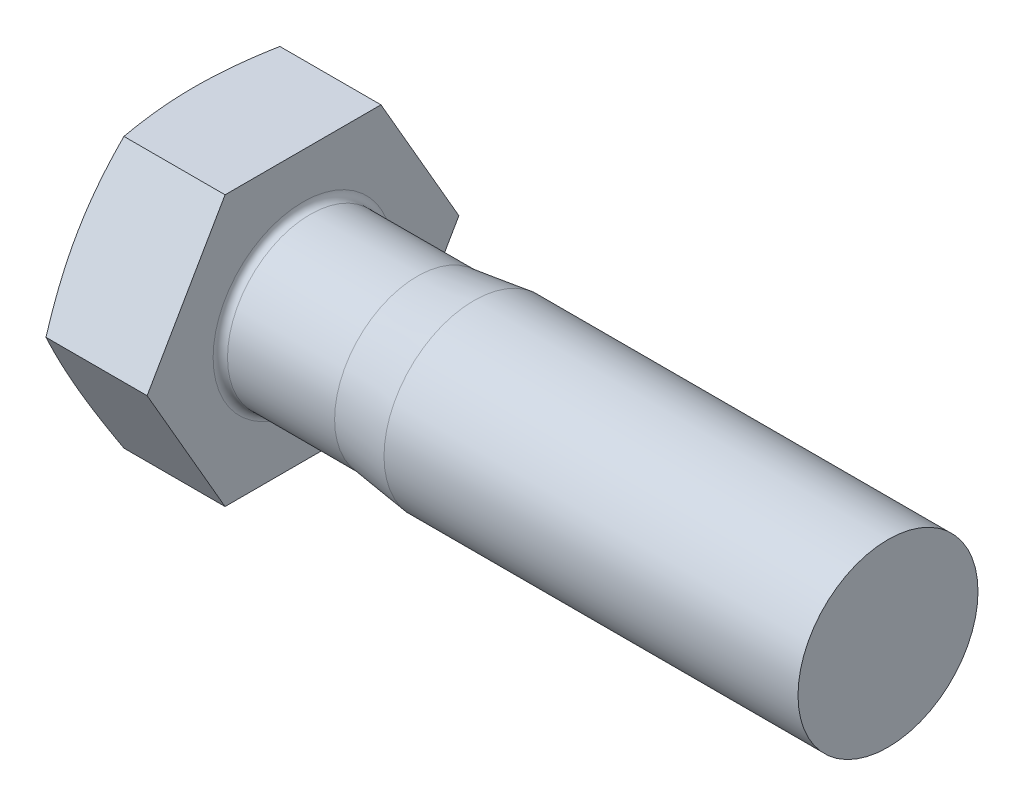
SolidWorks part; units mm, degrees
ref_plane "Front" through (0, 0, 0) normal (0, 0, 1) x (1, 0, 0)
ref_plane "Top" through (0, 0, 0) normal (0, 1, 0) x (1, 0, 0)
ref_plane "Right" through (0, 0, 0) normal (1, 0, 0) x (0, 0, -1)
sketch "Sketch1" plane through (0, 0, 0) normal (1, 0, 0) x (0, 0, -1)
  line L1 (17.3205, 0) -> (8.6603, 15)
  line L2 (8.6603, 15) -> (-8.6603, 15)
  line L3 (-8.6603, 15) -> (-17.3205, 0)
  line L4 (-17.3205, 0) -> (-8.6603, -15)
  line L5 (-8.6603, -15) -> (8.6603, -15)
  line L6 (8.6603, -15) -> (17.3205, 0)
  circle A0 centre (0, 0) radius 15 construction
  dimension "s" = 30
extrude "BaseHead" add sketch "Sketch1" along normal blind 12.5
ref_plane "Plane1" through (31.5, 0, 0) normal (1, 0, 0) x (0, 0, -1)
sketch "Sketch2" plane through (12.5, 0, 0) normal (1, 0, 0) x (0, 0, -1)
  circle A0 centre (0, 0) radius 10
  dimension "d" = 20
extrude "BaseBody" add sketch "Sketch2" along normal blind 65
sketch "Sketch3" plane through (3.1612, 0, 2.6123) normal (0, 1, 0) x (0, 0, -1)
  line L0 (2.6123, 5.2326) -> (2.6123, 1.6388) construction
  line L2 (19.9328, 3.1612) -> (19.9328, 1.8981)
  line L3 (19.9328, 1.8981) -> (16.4623, 3.1612)
  line L5 (16.4623, 3.1612) -> (19.9328, 3.1612)
  dimension "D1" = 20
  dimension "dw" = 27.7
revolve "HeadChamfer" cut sketch "Sketch3" angle 360 about L0
sketch "Sketch4" plane through (0, 0, 0) normal (-1, 0, 0) x (0, 0, 1)
  circle A0 centre (0, 0) radius 11.2
  dimension "da" = 22.4
extrude "Cut-Extrude1" cut sketch "Sketch4" against normal blind 2.5
sketch "Sketch5" plane through (-2.6796, 0, 8.1796) normal (0, 1, 0) x (0, 0, -1)
  line L0 (8.1796, 0.0175) -> (8.1796, -16.2361) construction
  line L2 (18.1796, -34.1796) -> (17.3676, -27.8796)
  line L4 (17.3676, -27.8796) -> (17.3676, -15.1796)
  line L6 (17.3676, -15.1796) -> (26.5556, -15.1796)
  line L7 (26.5556, -15.1796) -> (26.5556, -34.1796)
  line L8 (26.5556, -34.1796) -> (18.1796, -34.1796)
  line L11 (8.1796, -80.1796) -> (8.1796, -15.1796) construction
  line L14 (16.8399, -15.1796) -> (-0.4806, -15.1796) construction
  line L16 (-1.8204, -80.1796) -> (18.1796, -80.1796) construction
  line L17 (18.1796, -80.1796) -> (18.1796, -15.1796) construction
  dimension "ds" = 18.376
  dimension "x" = 6.3
  dimension "D3" = 46
  dimension "D4" = 36.752
revolve "Cut-Revolve1" cut sketch "Sketch5" angle 360 about L0
fillet "HeadFillet" radius 0.8 1 edges at (12.5, 0, 9.188)
equation "\"D1@Cut-Extrude1\" = 0.2 * \"k@BaseHead\""
equation "\"b@ThreadCosmetic1\" = \"l@BaseBody\" - \"lg@Plane1\""
equation "\"D4@Sketch5\" = 2 * \"ds@Sketch5\""
equation "\"D3@Sketch5\" = \"l@BaseBody\" - \"lg@Plane1\""
